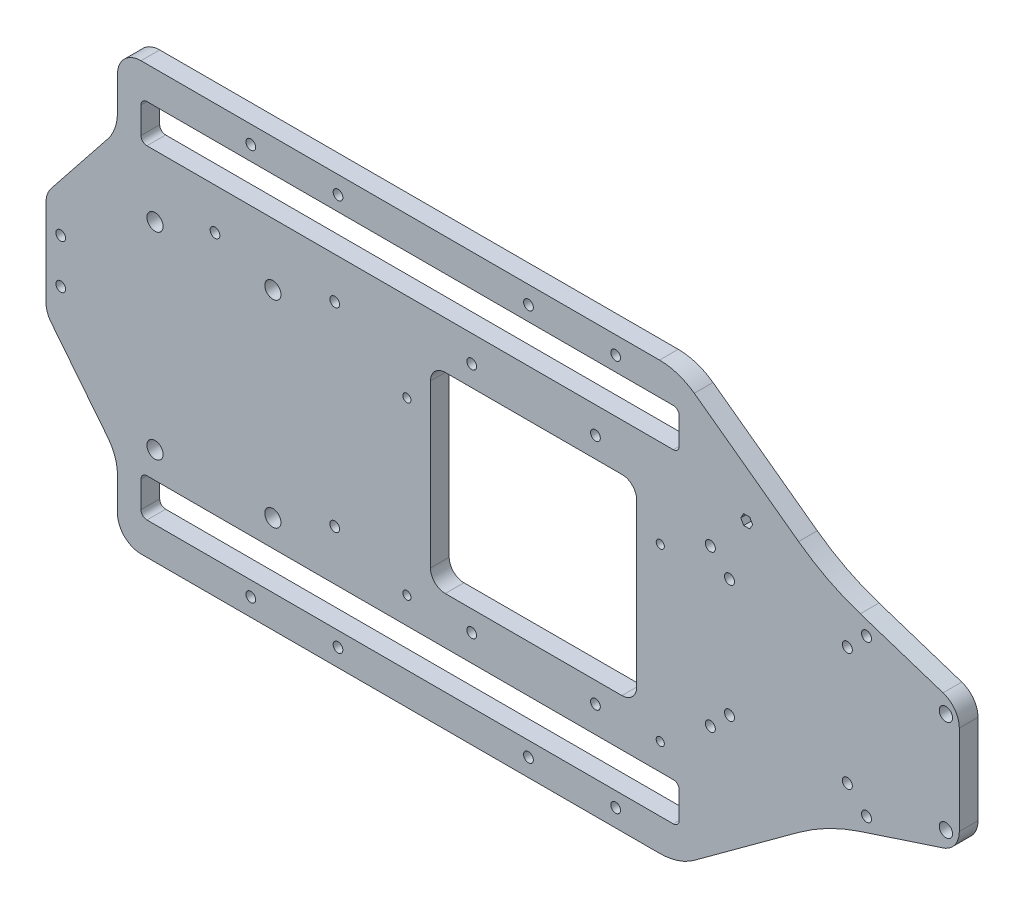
SolidWorks part; units mm, degrees
ref_plane "Front" through (0, 0, 0) normal (0, 0, 1) x (1, 0, 0)
ref_plane "Top" through (0, 0, 0) normal (0, 1, 0) x (1, 0, 0)
ref_plane "Right" through (0, 0, 0) normal (1, 0, 0) x (0, 0, -1)
sketch "V1_Outline" plane through (0, 0, 0) normal (0, 0, 1) x (1, 0, 0)
  line L24 (-129.25, -72.5) -> (53.2465, -72.5)
  line L25 (67.939, -66.0695) -> (70.2076, -63.6132)
  line L26 (74.3209, -60.0355) -> (100.2913, -42.0148)
  line L27 (121.3103, -31.8527) -> (151.4492, -22.7256)
  line L28 (155, -17.9402) -> (155, 17.9402)
  line L29 (151.4492, 22.7256) -> (121.3103, 31.8527)
  line L30 (100.2913, 42.0148) -> (74.3209, 60.0355)
  line L31 (70.2076, 63.6132) -> (67.939, 66.0695)
  line L32 (53.2465, 72.5) -> (-129.25, 72.5)
  line L33 (-130.75, 71) -> (-130.75, 47.9125)
  line L34 (-155, 17.3559) -> (-155, -17.3559)
  line L35 (-130.75, -47.9125) -> (-130.75, -71)
  circle A10 centre (150.446, -17.05) radius 2.25
  circle A11 centre (150.446, 17.05) radius 2.25
  arc A24 (53.2465, -72.5) -> (67.939, -66.0695) centre (53.2465, -52.5) ccw
  arc A25 (74.3209, -60.0355) -> (70.2076, -63.6132) centre (88.5732, -80.5751) ccw
  arc A26 (121.3103, -31.8527) -> (100.2913, -42.0148) centre (143.0481, -103.6334) ccw
  arc A27 (151.4492, -22.7256) -> (155, -17.9402) centre (150, -17.9402) ccw
  arc A28 (155, 17.9402) -> (151.4492, 22.7256) centre (150, 17.9402) ccw
  arc A29 (100.2913, 42.0148) -> (121.3103, 31.8527) centre (143.0481, 103.6334) ccw
  arc A30 (70.2076, 63.6132) -> (74.3209, 60.0355) centre (88.5732, 80.5751) ccw
  arc A31 (67.939, 66.0695) -> (53.2465, 72.5) centre (53.2465, 52.5) ccw
  arc A32 (-129.25, 72.5) -> (-130.75, 71) centre (-129.25, 71) ccw
  arc A33 (-154.623, 18.5245) -> (-155, 17.3559) centre (-153, 17.3559) ccw
  arc A34 (-155, -17.3559) -> (-154.623, -18.5245) centre (-153, -17.3559) ccw
  arc A35 (-130.75, -71) -> (-129.25, -72.5) centre (-129.25, -71) ccw
  circle A36 centre (-85.4843, -66.5) radius 1.65
  circle A37 centre (-55.8843, -66.5) radius 1.65
  circle A38 centre (8.7657, -66.5) radius 1.65
  circle A39 centre (38.3657, -66.5) radius 1.65
  circle A40 centre (38.3657, 66.5) radius 1.65
  circle A41 centre (8.7657, 66.5) radius 1.65
  circle A42 centre (-55.8843, 66.5) radius 1.65
  circle A43 centre (-85.4843, 66.5) radius 1.65
  spline S8 degree 3 poles (-130.75, 47.9125) (-135.9834, 42.0238) (-141.1462, 36.1695) (-147, 28.6896) knots 0.459269 0.459269 0.459269 0.459269 0.837338 0.837338 0.837338 0.837338
  spline S9 degree 3 poles (-147, 28.6896) (-149.4066, 25.6144) (-151.9299, 22.2645) (-154.623, 18.5245) knots 0.837338 0.837338 0.837338 0.837338 0.992769 0.992769 0.992769 0.992769
  spline S10 degree 3 poles (-154.623, -18.5245) (-151.9299, -22.2645) (-149.4066, -25.6144) (-147, -28.6896) knots 0.007231 0.007231 0.007231 0.007231 0.162662 0.162662 0.162662 0.162662
  spline S11 degree 3 poles (-147, -28.6896) (-141.1462, -36.1695) (-135.9834, -42.0238) (-130.75, -47.9125) knots 0.459269 0.459269 0.459269 0.459269 0.837338 0.837338 0.837338 0.837338
sketch "Sketch2" plane through (0, 0, 0) normal (0, 0, 1) x (1, 0, 0)
  line L1 (155, -72.5) -> (-155, -72.5)
  line L2 (155, -72.5) -> (155, 72.5)
  line L3 (155, 72.5) -> (-155, 72.5)
  line L4 (-155, -72.5) -> (-155, 72.5)
  line L5 (155, -72.5) -> (-155, 72.5) construction
  line L6 (155, 72.5) -> (-155, -72.5) construction
  point P0 (0, 0)
  dimension "D1" = 310
  dimension "D2" = 145
extrude "Base" add sketch "Sketch2" along normal mid plane 6.35
sketch "Sketch8" plane through (0, 0, 0) normal (0, 0, 1) x (1, 0, 0)
  line L0 (0, 0) -> (-155, 0) construction
  line L1 (-155, 72.5) -> (-155, -72.5) construction
  line L2 (-155, -17.5) -> (-155, 17.5)
  line L3 (-155, 17.5) -> (-130.75, 48)
  line L4 (-130.75, 48) -> (-130.75, 72.5)
  line L5 (155, 72.5) -> (-155, 72.5) construction
  line L6 (-130.75, 72.5) -> (53.25, 72.5)
  line L8 (155, -72.5) -> (155, 72.5) construction
  line L9 (155, 21) -> (121.4, 32)
  line L16 (65.0596, 68.6411) -> (100.449, 42.7485)
  line L17 (65.0596, -68.6411) -> (100.449, -42.7485)
  line L18 (155, -21) -> (121.4, -32)
  line L19 (-130.75, -72.5) -> (53.25, -72.5)
  line L20 (-130.75, -48) -> (-130.75, -72.5)
  line L21 (-155, -17.5) -> (-130.75, -48)
  arc A0 (53.25, 72.5) -> (65.0596, 68.6411) centre (53.25, 52.5) cw
  arc A1 (121.4, 32) -> (100.449, 42.7485) centre (144.7349, 103.2775) cw
  arc A4 (121.4, -32) -> (100.449, -42.7485) centre (144.7349, -103.2775) ccw
  arc A5 (53.25, -72.5) -> (65.0596, -68.6411) centre (53.25, -52.5) ccw
  point P21 (155, 0)
  dimension "D5" = 20
  dimension "D7" = 75
  dimension "D1" = 35
  dimension "D2" = 24.25
  dimension "D3" = 30.5
  dimension "D4" = 184
  dimension "D6" = 42
  dimension "D8" = 33.6
  dimension "D9" = 11
extrude "Outline Cut" cut sketch "Sketch8" against normal through all both and the other way through all flip side to cut
sketch "Sketch20" plane through (0, 0, 0) normal (0, 0, 1) x (1, 0, 0)
  circle A0 centre (150.446, -17.05) radius 2.25 construction
  circle A1 centre (150.446, 17.05) radius 2.25 construction
  circle A2 centre (38.3657, -66.5) radius 1.65 construction
  circle A3 centre (8.7657, -66.5) radius 1.65 construction
  circle A4 centre (-55.8843, -66.5) radius 1.65 construction
  circle A5 centre (-85.4843, -66.5) radius 1.65 construction
  circle A6 centre (38.3657, 66.5) radius 1.65 construction
  circle A7 centre (8.7657, 66.5) radius 1.65 construction
  circle A8 centre (-55.8843, 66.5) radius 1.65 construction
  circle A9 centre (-85.4843, 66.5) radius 1.65 construction
  circle A10 centre (150.446, -17.05) radius 2.25
  circle A11 centre (150.446, 17.05) radius 2.25
  circle A12 centre (38.3657, -66.5) radius 1.65
  circle A13 centre (8.7657, -66.5) radius 1.65
  circle A14 centre (-55.8843, -66.5) radius 1.65
  circle A15 centre (-85.4843, -66.5) radius 1.65
  circle A16 centre (38.3657, 66.5) radius 1.65
  circle A17 centre (8.7657, 66.5) radius 1.65
  circle A18 centre (-55.8843, 66.5) radius 1.65
  circle A19 centre (-85.4843, 66.5) radius 1.65
extrude "M3 Mounting Holes" cut sketch "Sketch20" against normal through all both and the other way through all
fillet "Fillet2" radius 15 2 edges at (-130.75, 48, 0) (-130.75, -48, 0)
fillet "Fillet1" radius 8 6 edges at (155, -21, 0) (155, 21, 0) (-130.75, -72.5, 0) (-155, -17.5, 0) (-155, 17.5, 0) (-130.75, 72.5, 0)
sketch "Sketch21" plane through (0, 0, 0) normal (0, 0, 1) x (1, 0, 0)
  line L0 (53.2465, 72.5) -> (-129.25, 72.5) construction
  line L1 (57.939, 48.5) -> (-120.75, 48.5)
  line L2 (59.939, 50.5) -> (59.939, 59.5)
  line L3 (57.939, 61.5) -> (-120.75, 61.5)
  line L4 (-122.75, 50.5) -> (-122.75, 59.5)
  line L5 (59.939, 48.5) -> (-122.75, 61.5) construction
  line L6 (59.939, 61.5) -> (-122.75, 48.5) construction
  line L7 (-130.75, 71) -> (-130.75, 47.9125) construction
  line L8 (-155, 0) -> (0, 0) construction
  line L9 (-155, 17.3559) -> (-155, -17.3559) construction
  line L10 (59.939, -61.5) -> (-122.75, -48.5) construction
  line L11 (59.939, -48.5) -> (-122.75, -61.5) construction
  line L12 (-122.75, -50.5) -> (-122.75, -59.5)
  line L13 (57.939, -61.5) -> (-120.75, -61.5)
  line L14 (59.939, -50.5) -> (59.939, -59.5)
  line L15 (57.939, -48.5) -> (-120.75, -48.5)
  arc A0 (57.939, 48.5) -> (59.939, 50.5) centre (57.939, 50.5) ccw
  arc A1 (59.939, 59.5) -> (57.939, 61.5) centre (57.939, 59.5) ccw
  arc A2 (-120.75, 48.5) -> (-122.75, 50.5) centre (-120.75, 50.5) cw
  arc A3 (-120.75, 61.5) -> (-122.75, 59.5) centre (-120.75, 59.5) ccw
  arc A4 (-120.75, -61.5) -> (-122.75, -59.5) centre (-120.75, -59.5) cw
  arc A5 (-120.75, -48.5) -> (-122.75, -50.5) centre (-120.75, -50.5) ccw
  arc A6 (59.939, -59.5) -> (57.939, -61.5) centre (57.939, -59.5) cw
  arc A7 (57.939, -48.5) -> (59.939, -50.5) centre (57.939, -50.5) cw
  point P0 (-31.4055, 55)
  point P43 (-31.4055, -55)
  dimension "D5" = 2
  dimension "D1" = 13
  dimension "D2" = 11
  dimension "D3" = 8
  dimension "D4" = 8
extrude "Wire Slots" cut sketch "Sketch21" against normal through all both and the other way through all
sketch "Sketch3" plane through (0, 0, 0) normal (0, 0, 1) x (1, 0, 0)
  line L0 (0, 0) -> (-155, 0) construction
  line L1 (-155, 14.7072) -> (-155, -14.7072) construction
  circle A0 centre (-150, 7.5) radius 1.65
  circle A1 centre (-150, -7.5) radius 1.65
  dimension "D1" = 3.3
  dimension "D2" = 15
  dimension "D3" = 5
extrude "Antenna" cut sketch "Sketch3" against normal through all both and the other way through all
hole_wizard "M5 Vesc Holes" positions "Sketch4" profile "Sketch5" hole size "M5" standard "ANSI Metric"
sketch "Sketch4" plane through (0, 0, 3.175) normal (0, 0, 1) x (1, 0, 0)
  line L0 (-155, 0) -> (0, 0) construction
  line L1 (-155, 14.7072) -> (-155, -14.7072) construction
  line L3 (-118, 27.5) -> (-78, 27.5) construction
  line L4 (-118, 27.5) -> (-118, -39.5) construction
  line L5 (-118, -39.5) -> (-78, -39.5) construction
  line L6 (-78, 27.5) -> (-78, -39.5) construction
  line L7 (57.939, -48.5) -> (-120.75, -48.5) construction
  point P0 (-118, 27.5)
  point P2 (-78, 27.5)
  point P14 (-78, -39.5)
  point P61 (-118, -39.5)
  dimension "D1" = 40
  dimension "D2" = 67
  dimension "D3" = 37
  dimension "D4" = 9
sketch "Sketch5" plane through (-118, 27.5, 3.175) normal (1, 0, 0) x (0, -1, 0)
  line L0 (0, 0) -> (0, 6.35)
  line L1 (0, 6.35) -> (2.75, 6.35)
  line L2 (2.75, 6.35) -> (2.75, 0)
  line L5 (2.75, 0) -> (0, 0)
  line L11 (0, -6.35) -> (0, 107.95) construction
  dimension "Thru Hole Dia." = 5.5
  dimension "Thru Hole Depth" = 6.35
sketch "Vesc Outline" plane through (0, 0, 0) normal (0, 0, 1) x (1, 0, 0)
  line L0 (-118, 27.5) -> (-78, -39.5) construction
  line L2 (-133, -43.5) -> (-63, -43.5)
  line L3 (-133, -43.5) -> (-133, 31.5)
  line L4 (-133, 31.5) -> (-63, 31.5)
  line L5 (-63, -43.5) -> (-63, 31.5)
  line L6 (-133, -43.5) -> (-63, 31.5) construction
  line L7 (-133, 31.5) -> (-63, -43.5) construction
  point P4 (-98, -6)
  dimension "D1" = 70
  dimension "D2" = 75
sketch "Sketch7" plane through (0, 0, 0) normal (0, 0, 1) x (1, 0, 0)
  line L0 (-97.64, 34.5) -> (-57, 34.5) construction
  line L1 (-97.64, 34.5) -> (-97.64, -31.54) construction
  line L2 (-57, 34.5) -> (-57, -31.54) construction
  line L3 (-97.64, -31.54) -> (-57, -31.54) construction
  line L5 (-78, 27.5) -> (-57, 27.5) construction
  circle A0 centre (-97.64, 34.5) radius 1.65
  circle A1 centre (-57, 34.5) radius 1.65
  circle A2 centre (-57, -31.54) radius 1.65
  dimension "D3" = 3.3
  dimension "D1" = 40.64
  dimension "D2" = 66.04
  dimension "D4" = 21
  dimension "D5" = 7
extrude "Powerboard" cut sketch "Sketch7" against normal through all both and the other way through all
sketch "10LX" plane through (0, 0, 0) normal (0, 0, 1) x (1, 0, 0)
  line L1 (117, -20) -> (77, -20) construction
  line L2 (117, -20) -> (117, 20) construction
  line L3 (117, 20) -> (77, 20) construction
  line L4 (77, -20) -> (77, 20) construction
  line L5 (117, -20) -> (77, 20) construction
  line L6 (117, 20) -> (77, -20) construction
  line L7 (155, -17.9402) -> (155, 17.9402) construction
  point P0 (97, 0)
  dimension "D1" = 40
  dimension "D2" = 38
sketch "30LX" plane through (0, 0, 0) normal (0, 0, 1) x (1, 0, 0)
  line L1 (123.5, -26.5) -> (70.5, -26.5) construction
  line L2 (123.5, -26.5) -> (123.5, 26.5) construction
  line L3 (123.5, 26.5) -> (70.5, 26.5) construction
  line L4 (70.5, -26.5) -> (70.5, 26.5) construction
  line L5 (123.5, -26.5) -> (70.5, 26.5) construction
  line L6 (123.5, 26.5) -> (70.5, -26.5) construction
  point P0 (97, 0)
  dimension "D1" = 53
hole_wizard "M3 Clearance Hole1" positions "Sketch25" profile "Sketch26" hole size "M3" standard "ANSI Metric"
sketch "Sketch25" plane through (0, 0, 3.175) normal (0, 0, 1) x (1, 0, 0)
  point P0 (70.5, 26.5)
  point P3 (77, 20)
  point P6 (70.5, -26.5)
  point P9 (77, -20)
  point P12 (123.5, -26.5)
  point P15 (117, -20)
  point P18 (117, 20)
  point P21 (123.5, 26.5)
sketch "Sketch26" plane through (70.5, 26.5, 3.175) normal (1, 0, 0) x (0, -1, 0)
  line L0 (0, 0) -> (0, 6.35)
  line L1 (0, 6.35) -> (1.7, 6.35)
  line L2 (1.7, 6.35) -> (1.7, 0)
  line L5 (1.7, 0) -> (0, 0)
  line L11 (0, -6.35) -> (0, 107.95) construction
  dimension "Thru Hole Dia." = 3.4
  dimension "Thru Hole Depth" = 6.35
sketch "Xavier Outline" plane through (0, 0, 0) normal (0, 0, 1) x (1, 0, 0)
  line L0 (57.939, -48.5) -> (-120.75, -48.5) construction
  line L1 (53.5, -39.5) -> (-32.5, -39.5) construction
  line L2 (53.5, -39.5) -> (53.5, 18.5) construction
  line L3 (53.5, 18.5) -> (-32.5, 18.5) construction
  line L4 (-32.5, -39.5) -> (-32.5, 18.5) construction
  line L5 (53.5, -39.5) -> (-32.5, 18.5) construction
  line L6 (53.5, 18.5) -> (-32.5, -39.5) construction
  line L7 (57.5, -43.5) -> (-42.5, -43.5) construction
  line L8 (57.5, -43.5) -> (57.5, 35.5) construction
  line L9 (57.5, 35.5) -> (-42.5, 35.5) construction
  line L10 (-42.5, -43.5) -> (-42.5, 35.5) construction
  line L11 (57.5, -43.5) -> (-42.5, 35.5) construction
  line L12 (57.5, 35.5) -> (-42.5, -43.5) construction
  line L13 (70.5, -26.5) -> (70.5, 26.5) construction
  circle A0 centre (-32.5, 18.5) radius 1.375
  circle A1 centre (53.5, 18.5) radius 1.375
  circle A2 centre (53.5, -39.5) radius 1.375
  circle A3 centre (-32.5, -39.5) radius 1.375
  point P0 (10.5, -10.5)
  point P8 (7.5, -4)
  dimension "D9" = 2.75
  dimension "D1" = 58
  dimension "D2" = 86
  dimension "D3" = 4
  dimension "D4" = 79
  dimension "D5" = 100
  dimension "D6" = 10
  dimension "D7" = 5
  dimension "D8" = 13
extrude "Xavier" cut sketch "Xavier Outline" against normal through all both and the other way through all
sketch "Sketch30" plane through (0, 0, 0) normal (0, 0, 1) x (1, 0, 0)
  line L0 (-32.5, 18.5) -> (53.5, 18.5) construction
  line L1 (10.5, 48.5) -> (10.5, -48.5) construction
  line L2 (31.5, -39.5) -> (-10.5, -39.5) construction
  line L3 (31.5, -39.5) -> (31.5, 39.5) construction
  line L4 (31.5, 39.5) -> (-10.5, 39.5) construction
  line L5 (-10.5, -39.5) -> (-10.5, 39.5) construction
  line L6 (31.5, -39.5) -> (-10.5, 39.5) construction
  line L7 (31.5, 39.5) -> (-10.5, -39.5) construction
  line L8 (-120.75, 48.5) -> (57.939, 48.5) construction
  line L9 (57.939, -48.5) -> (-120.75, -48.5) construction
  circle A0 centre (-10.5, 39.5) radius 1.65
  circle A1 centre (31.5, 39.5) radius 1.65
  circle A2 centre (31.5, -39.5) radius 1.65
  circle A3 centre (-10.5, -39.5) radius 1.65
  point P4 (10.5, 0)
  point P11 (10.5, 18.5)
  point P19 (10.5, 0)
  dimension "D3" = 3.3
  dimension "D1" = 42
  dimension "D2" = 79
extrude "TX2" cut sketch "Sketch30" against normal through all both and the other way through all
sketch "Sketch29" plane through (0, 0, 0) normal (0, 0, 1) x (1, 0, 0)
  line L1 (40.5, 32.5) -> (-19.5, 32.5)
  line L2 (45.5, 27.5) -> (45.5, -27.5)
  line L3 (40.5, -32.5) -> (-19.5, -32.5)
  line L4 (-24.5, 27.5) -> (-24.5, -27.5)
  line L5 (45.5, 32.5) -> (-24.5, -32.5) construction
  line L6 (45.5, -32.5) -> (-24.5, 32.5) construction
  line L8 (-120.75, 48.5) -> (57.939, 48.5) construction
  line L9 (53.5, -39.5) -> (53.5, 18.5) construction
  arc A0 (-19.5, -32.5) -> (-24.5, -27.5) centre (-19.5, -27.5) cw
  arc A1 (45.5, -27.5) -> (40.5, -32.5) centre (40.5, -27.5) cw
  arc A2 (40.5, 32.5) -> (45.5, 27.5) centre (40.5, 27.5) cw
  arc A3 (-19.5, 32.5) -> (-24.5, 27.5) centre (-19.5, 27.5) ccw
  point P0 (10.5, 0)
  dimension "D3" = 5
  dimension "D1" = 16
  dimension "D2" = 8
extrude "Wire slot" cut sketch "Sketch29" against normal through all both and the other way through all
sketch "Sketch28" plane through (0, 0, 0) normal (0, 0, 1) x (1, 0, 0)
  line L1 (80.816, 39.9112) -> (81.8263, 38.1612)
  line L2 (81.8263, 38.1612) -> (83.8471, 38.1612)
  line L3 (83.8471, 38.1612) -> (84.8574, 39.9112)
  line L4 (84.8574, 39.9112) -> (83.8471, 41.6612)
  line L5 (83.8471, 41.6612) -> (81.8263, 41.6612)
  line L6 (81.8263, 41.6612) -> (80.816, 39.9112)
  circle A0 centre (82.8367, 39.9112) radius 1.75 construction
  dimension "D1" = 3.5
extrude "Top Marker" cut sketch "Sketch28" against normal through all both and the other way through all
